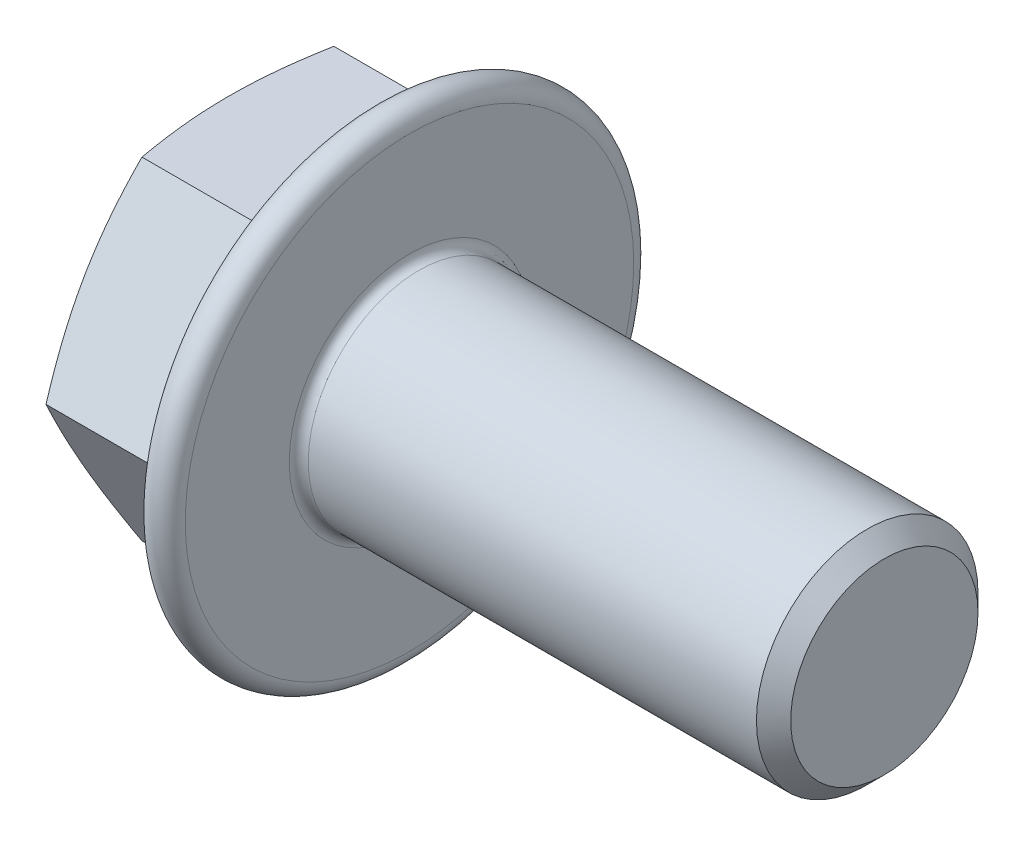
SolidWorks part; units mm, degrees
ref_plane "Front" through (0, 0, 0) normal (0, 0, 1) x (1, 0, 0)
ref_plane "Top" through (0, 0, 0) normal (0, 1, 0) x (1, 0, 0)
ref_plane "Right" through (0, 0, 0) normal (1, 0, 0) x (0, 0, -1)
sketch "Sketch1" plane through (0, 0, 0) normal (1, 0, 0) x (0, 0, -1)
  line L1 (12.1244, 0) -> (6.0622, 10.5)
  line L2 (6.0622, 10.5) -> (-6.0622, 10.5)
  line L3 (-6.0622, 10.5) -> (-12.1244, 0)
  line L4 (-12.1244, 0) -> (-6.0622, -10.5)
  line L5 (-6.0622, -10.5) -> (6.0622, -10.5)
  line L6 (6.0622, -10.5) -> (12.1244, 0)
  circle A0 centre (0, 0) radius 10.5 construction
  dimension "s" = 21
extrude "BaseHead" add sketch "Sketch1" along normal blind 12.4
ref_plane "Plane1" through (18.4, 0, 0) normal (1, 0, 0) x (0, 0, -1)
sketch "Sketch2" plane through (12.4, 0, 0) normal (1, 0, 0) x (0, 0, -1)
  circle A0 centre (0, 0) radius 7
  dimension "d" = 14
extrude "BaseBody" add sketch "Sketch2" along normal blind 30
sketch "Sketch3" plane through (-0.4952, 0, 6.2687) normal (0, 1, 0) x (0, 0, -1)
  line L0 (18.3931, -0.4952) -> (18.3931, -2.0509)
  line L2 (18.3931, -2.0509) -> (14.1187, -0.4952)
  line L4 (14.1187, -0.4952) -> (18.3931, -0.4952)
  line L5 (6.2687, 4.1693) -> (6.2687, -11.9236) construction
  dimension "D1" = 20
  dimension "da" = 15.7
revolve "HeadChamfer" cut sketch "Sketch3" angle 360 about L5
sketch "Sketch5" plane through (-0.1752, 0, 7.2752) normal (0, 1, 0) x (0, 0, -1)
  line L0 (7.2752, -12.5752) -> (7.2752, -7.1738) construction
  line L2 (7.2752, -12.5752) -> (21.4425, -12.5752)
  line L3 (21.8128, -10.4752) -> (7.2752, -5.1839)
  line L4 (7.2752, -5.1839) -> (7.2752, -12.5752)
  line L7 (7.2752, 4.4893) -> (7.2752, -11.6035) construction
  arc A0 (21.4425, -12.5752) -> (21.8128, -10.4752) centre (21.4425, -11.4925) ccw
  dimension "D3" = 20
  dimension "c" = 2.1
  dimension "dc" = 30.5
revolve "Flange" add sketch "Sketch5" angle 360 about L0
fillet "HeadFillet" radius 0.6 1 edges at (12.4, 0, 7)
fillet "FlangeHexFillet" radius 0.9 6 edges
chamfer "Chamfer1" distance 1.0825 angle 45 1 edges at (42.4, 0, -7)
equation "\"D1@Chamfer1\" = (  \"d@Sketch2\" - \"D2@ThreadCosmetic1\" )  / 2"
equation "\"b@ThreadCosmetic1\" = \"l@BaseBody\" - \"lg@Plane1\""
equation "\"da@Sketch3\" = \"s@Sketch1\""
